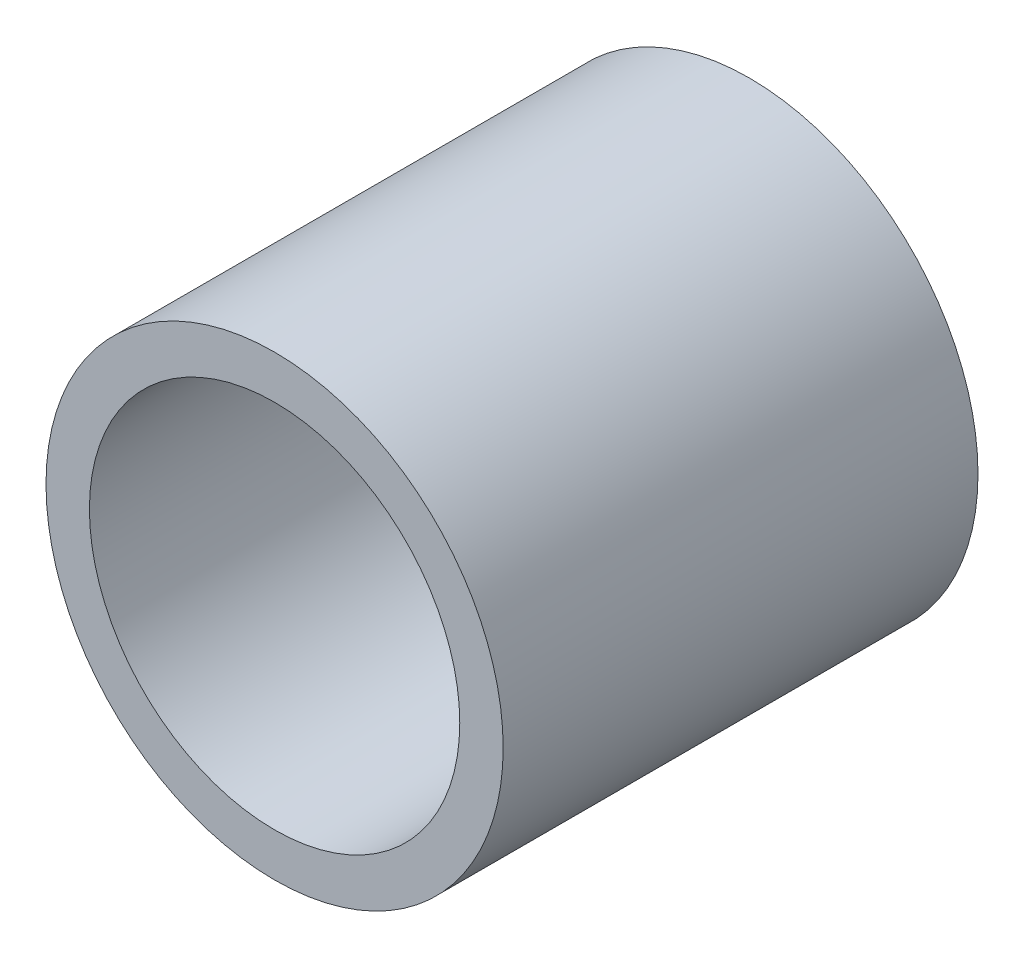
SolidWorks part; units mm, degrees
ref_plane "Front" through (0, 0, 0) normal (0, 0, 1) x (1, 0, 0)
ref_plane "Top" through (0, 0, 0) normal (0, 1, 0) x (1, 0, 0)
ref_plane "Right" through (0, 0, 0) normal (1, 0, 0) x (0, 0, -1)
sketch "Sketch1" plane through (0, 0, 0) normal (0, 0, 1) x (1, 0, 0)
  circle A0 centre (0, 0) radius 16.85
  circle A1 centre (0, 0) radius 13.65
  dimension "OD" = 33.7
  dimension "Thickness" = 3.2
extrude "Extrude1" add sketch "Sketch1" along normal mid plane 35
